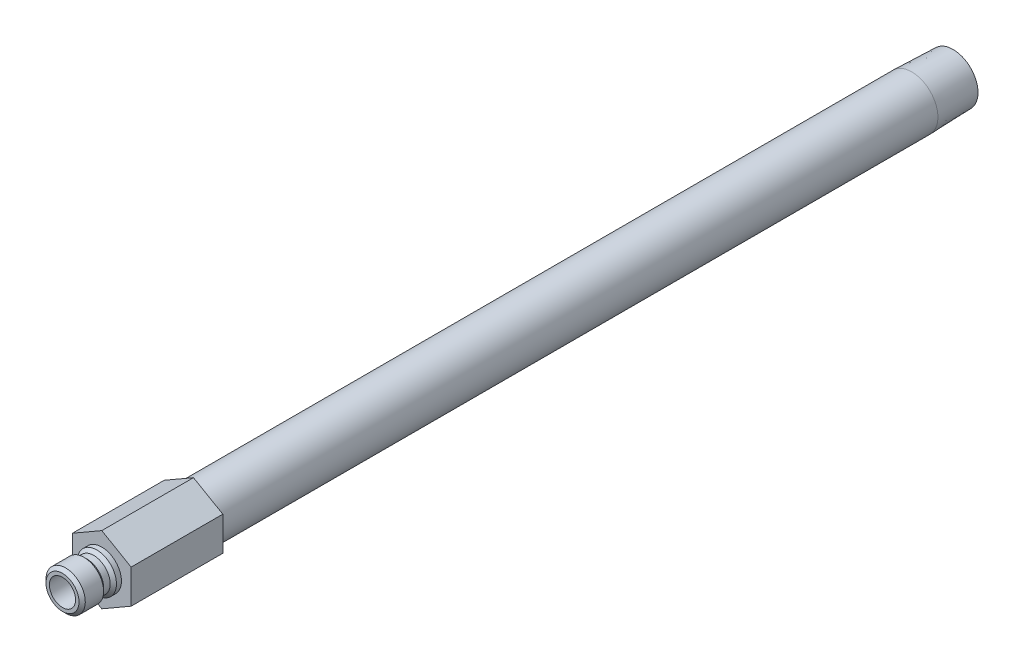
SolidWorks part; units mm, degrees
ref_plane "Front Plane" through (0, 0, 0) normal (0, 0, 1) x (1, 0, 0)
ref_plane "Top Plane" through (0, 0, 0) normal (0, 1, 0) x (1, 0, 0)
ref_plane "Right Plane" through (0, 0, 0) normal (1, 0, 0) x (0, 0, -1)
sketch "Sketch1" plane through (0, 0, 0) normal (1, 0, 0) x (0, 0, -1)
  line L0 (0, 0) -> (-12.7, 0) construction
  line L1 (-9.525, 3.175) -> (-9.525, 4.0005)
  line L2 (-3.556, 4.0005) -> (-3.556, 0) construction
  line L3 (-8.763, 4.7625) -> (-4.318, 4.7625)
  line L4 (0, 6.35) -> (0, 0) construction
  line L5 (-3.556, 4.0005) -> (-1.9685, 4.0005)
  line L6 (-1.2065, 4.7625) -> (0, 4.7625)
  line L7 (0, 4.7625) -> (0, 6.35)
  line L8 (-3.556, 4.0005) -> (-4.318, 4.7625)
  line L9 (-1.9685, 4.0005) -> (-1.2065, 4.7625)
  line L10 (-9.525, 4.0005) -> (-8.763, 4.7625)
  line L11 (22.225, 4.6228) -> (206.375, 4.6228)
  line L12 (0, 6.35) -> (196.342, 6.35)
  line L13 (196.342, 6.35) -> (206.375, 6.0365)
  line L14 (206.375, 6.0365) -> (206.375, 4.6228)
  line L15 (0, 0) -> (22.225, 0) construction
  line L16 (22.225, 0) -> (22.225, 4.7625) construction
  line L17 (22.225, 4.7625) -> (0, 4.7625) construction
  line L18 (22.225, 4.6228) -> (22.225, 3.175)
  line L19 (22.225, 3.175) -> (-9.525, 3.175)
  dimension "D1" = 9.525
  dimension "D2" = 1.5875
  dimension "D3" = 0.762
  dimension "D4" = 45
  dimension "D5" = 5.969
  dimension "D6" = 45
  dimension "D7" = 1.79
  dimension "D8" = 10.033
  dimension "D9" = 215.9
  dimension "D10" = 3.175
  dimension "D11" = 31.75
  dimension "D12" = 9.2456
  dimension "D13" = 6.35
  dimension "D14" = 9.525
  dimension "D15" = 12.7
revolve "Revolve1" add sketch "Sketch1" angle 360 about L0
sketch "Sketch2" plane through (0, 0, 0) normal (0, 0, 1) x (1, 0, 0)
  line L1 (-7.112, 4.1061) -> (-7.112, -4.1061)
  line L2 (-7.112, -4.1061) -> (0, -8.2122)
  line L3 (0, -8.2122) -> (7.112, -4.1061)
  line L4 (7.112, -4.1061) -> (7.112, 4.1061)
  line L5 (7.112, 4.1061) -> (0, 8.2122)
  line L6 (0, 8.2122) -> (-7.112, 4.1061)
  circle A0 centre (0, 0) radius 7.112 construction
  circle A1 centre (0, 0) radius 3.175 construction
  circle A2 centre (0, 0) radius 3.175
  dimension "D1" = 14.224
extrude "Boss-Extrude1" add sketch "Sketch2" against normal up to vertex (22.225 mm away) from vertex at 0
